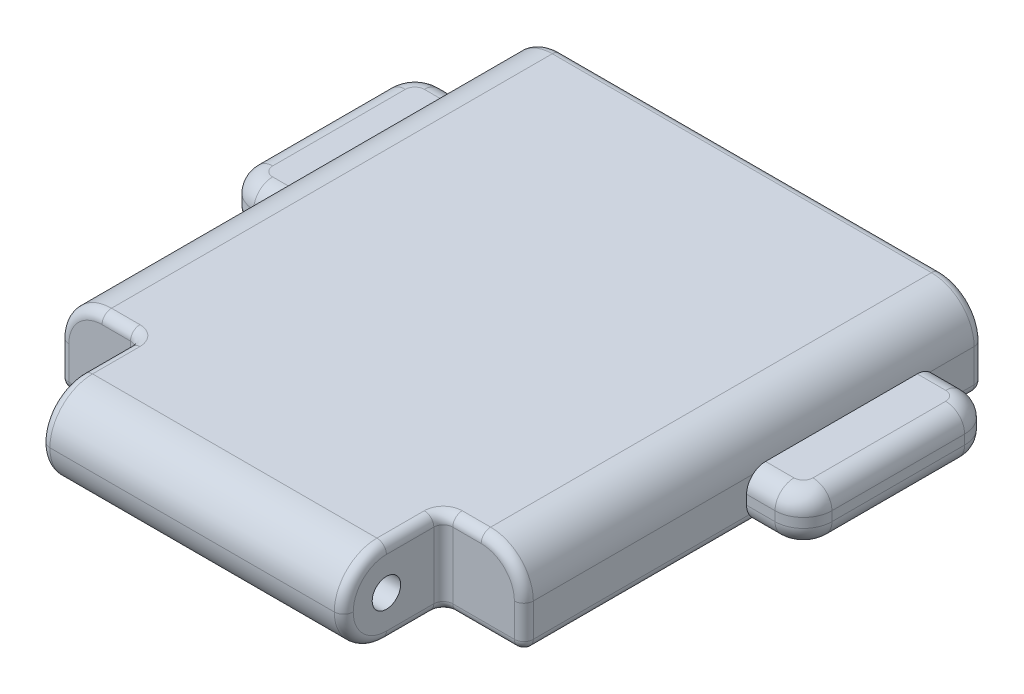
SolidWorks part; units mm, degrees
ref_plane "Front Plane" through (0, 0, 0) normal (0, 0, 1) x (1, 0, 0)
ref_plane "Top Plane" through (0, 0, 0) normal (0, 1, 0) x (1, 0, 0)
ref_plane "Right Plane" through (0, 0, 0) normal (1, 0, 0) x (0, 0, -1)
sketch "Sketch3" plane through (0, 0, 0) normal (0, 1, 0) x (1, 0, 0)
  line L0 (-7, 9.5) -> (1.5, 9.5)
  line L1 (1.5, -1) -> (33.5, -1)
  line L2 (-7, 9.5) -> (-7, 58)
  line L3 (-7, 58) -> (42, 58)
  line L4 (42, 9.5) -> (42, 58)
  line L5 (1.5, -1) -> (33.5, -1)
  line L6 (1.5, -1) -> (1.5, 9.5)
  line L8 (33.5, 9.5) -> (42, 9.5)
  line L16 (33.5, -1) -> (33.5, 9.5)
  dimension "D2" = 48.5
  dimension "D3" = 10.5
  dimension "D5" = 49
  dimension "D10" = 8.5
  dimension "D11" = 8.5
extrude "Boss-Extrude1" add sketch "Sketch3" along normal blind 9 contours L1 L16 L8 L4 L3 L2 L0 L6
fillet "Fillet4" radius 4.5 4 edges at (17.5, 0, 1) (17.5, 9, 1) (42, 9, -33.75) (-7, 9, -33.75)
sketch "Sketch6" plane through (0, 0, 0) normal (0, -1, 0) x (1, 0, 0)
  line L0 (-7, -9.5) -> (-7, -58) construction
  line L1 (-7, -53) -> (-10, -53)
  line L2 (-7, -53) -> (-7, -33)
  line L3 (-7, -33) -> (-10, -33)
  line L4 (-13, -50) -> (-13, -36)
  line L5 (-2.5, -58) -> (37.5, -58) construction
  line L6 (17.5, -58) -> (17.5, 1) construction
  line L7 (33.5, 1) -> (1.5, 1) construction
  line L8 (42, -33) -> (45, -33)
  line L9 (48, -50) -> (48, -36)
  line L10 (42, -53) -> (45, -53)
  line L11 (42, -53) -> (42, -33)
  arc A0 (-10, -33) -> (-13, -36) centre (-10, -36) ccw
  arc A1 (-10, -53) -> (-13, -50) centre (-10, -50) cw
  arc A2 (45, -33) -> (48, -36) centre (45, -36) cw
  arc A3 (45, -53) -> (48, -50) centre (45, -50) ccw
  point P7 (-13, -33)
  dimension "D3" = 3
  dimension "D1" = 6
  dimension "D2" = 20
  dimension "D4" = 5
extrude "Boss-Extrude3" add sketch "Sketch6" against normal blind 5
fillet "Fillet5" radius 2 20 edges at (-8.5, 0, -33) (-12.1213, 0, -33.8787) (-12.1213, 5, -33.8787) (-8.5, 0, -53) (-12.1213, 0, -52.1213) (-12.1213, 5, -52.1213) (-8.5, 5, -33) (-8.5, 5, -53) (-13, 0, -43) (-13, 5, -43) (43.5, 0, -53) (47.1213, 0, -52.1213) (47.1213, 5, -52.1213) (43.5, 0, -33) (47.1213, 0, -33.8787) (47.1213, 5, -33.8787) (43.5, 5, -53) (43.5, 5, -33) (48, 0, -43) (48, 5, -43)
sketch "Sketch7" plane through (0, 0, -58) normal (0, 0, -1) x (-1, 0, 0)
  line L0 (-22.5, 4.5) -> (-12.5, 4.5) construction
  line L1 (-22.5, 5.5) -> (-12.5, 5.5)
  line L2 (-22.5, 3.5) -> (-12.5, 3.5)
  line L3 (7, 0) -> (-42, 0) construction
  line L4 (2.5, 9) -> (-37.5, 9) construction
  arc A0 (-22.5, 5.5) -> (-22.5, 3.5) centre (-22.5, 4.5) ccw
  arc A1 (-12.5, 3.5) -> (-12.5, 5.5) centre (-12.5, 4.5) ccw
  point P2 (-17.5, 4.5)
  point P12 (-17.5, 9)
  dimension "D1" = 4.5
  dimension "D2" = 10
  dimension "D3" = 2
extrude "Boss-Extrude4" add sketch "Sketch7" along normal blind 0.8
fillet "Fillet6" radius 0.4 4 edges at (23.5, 4.5, -58) (17.5, 5.5, -58) (11.5, 4.5, -58) (17.5, 3.5, -58)
sketch "Sketch8" plane through (1.5, 0, 0) normal (-1, 0, 0) x (0, 0, 1)
  line L0 (-3.5, 9) -> (-9.5, 9) construction
  circle A0 centre (-3.5, 4.5) radius 1.5
  dimension "D3" = 3
  dimension "D1" = 4.5
  dimension "D2" = 4.5
extrude "Cut-Extrude2" cut sketch "Sketch8" against normal through all
fillet "Fillet7" radius 1 28 edges at (-7, 2.25, -58) (-5.682, 7.682, -58) (42, 2.25, -58) (40.682, 7.682, -58) (17.5, 0, -58) (42, 0, -54.5) (42, 0, -22.25) (-7, 0, -22.25) (-7, 0, -54.5) (17.5, 9, -58) (42, 2.25, -9.5) (35.5, 9, -9.5) (1.5, 0, -6.5) (1.5, 1.318, -0.318) (1.5, 7.682, -0.318) (-7, 2.25, -9.5) (-5.682, 7.682, -9.5) (33.5, 9, -6.5) (33.5, 7.682, -0.318) (33.5, 0, -6.5) (40.682, 7.682, -9.5) (-2.75, 0, -9.5) (1.5, 9, -6.5) (-0.5, 9, -9.5) (33.5, 1.318, -0.318) (37.75, 0, -9.5) (33.5, 4.5, -9.5) (1.5, 4.5, -9.5)
fillet "Fillet9" radius 1 4 edges at (17.5, 5.5, -58.8) (11.5, 4.5, -58.8) (17.5, 3.5, -58.8) (23.5, 4.5, -58.8)
